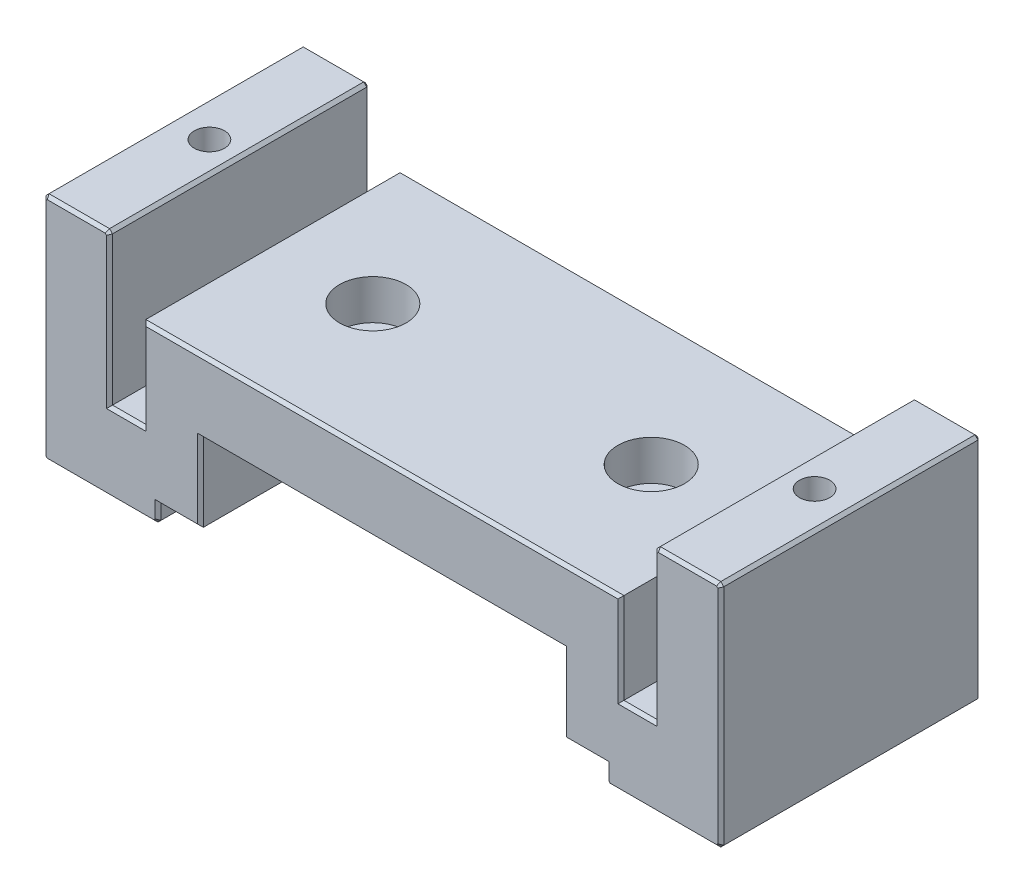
SolidWorks part; units mm, degrees
ref_plane "前视基准面" through (0, 0, 0) normal (0, 0, 1) x (1, 0, 0)
ref_plane "上视基准面" through (0, 0, 0) normal (0, 1, 0) x (1, 0, 0)
ref_plane "右视基准面" through (0, 0, 0) normal (1, 0, 0) x (0, 0, -1)
sketch "Model" plane through (0, 0, 0) normal (0, 0, 1) x (1, 0, 0)
  line L3 (-570.968, 2207.4695) -> (-570.968, 2209.9695)
  line L9 (-663.968, 2207.4695) -> (-663.968, 2244.4695)
  line L12 (-562.468, 2244.9695) -> (-562.968, 2244.4695)
  line L16 (-552.468, 2206.9695) -> (-551.968, 2207.4695)
  line L17 (-637.968, 2209.9695) -> (-644.968, 2209.9695)
  line L21 (-663.468, 2206.9695) -> (-663.968, 2207.4695)
  line L40 (-552.468, 2206.9695) -> (-570.468, 2206.9695)
  line L42 (-644.968, 2209.9695) -> (-644.968, 2207.4695)
  line L45 (-562.968, 2219.9695) -> (-562.968, 2244.4695)
  line L46 (-645.468, 2206.9695) -> (-663.468, 2206.9695)
  line L49 (-568.468, 2219.9695) -> (-562.968, 2219.9695)
  line L50 (-570.968, 2207.4695) -> (-570.468, 2206.9695)
  line L51 (-663.468, 2244.9695) -> (-663.968, 2244.4695)
  line L53 (-645.468, 2206.9695) -> (-644.968, 2207.4695)
  line L55 (-568.468, 2234.9695) -> (-568.468, 2219.9695)
  line L56 (-637.968, 2222.9695) -> (-637.968, 2209.9695)
  line L59 (-551.968, 2244.4695) -> (-552.468, 2244.9695)
  line L61 (-562.468, 2244.9695) -> (-552.468, 2244.9695)
  line L63 (-647.468, 2234.9695) -> (-568.468, 2234.9695)
  line L64 (-570.968, 2209.9695) -> (-577.968, 2209.9695)
  line L67 (-647.468, 2219.9695) -> (-647.468, 2234.9695)
  line L68 (-577.968, 2209.9695) -> (-577.968, 2222.9695)
  line L71 (-652.968, 2219.9695) -> (-647.468, 2219.9695)
  line L72 (-577.968, 2222.9695) -> (-637.968, 2222.9695)
  line L74 (-652.968, 2244.4695) -> (-652.968, 2219.9695)
  line L75 (-551.968, 2244.4695) -> (-551.968, 2207.4695)
  line L78 (-652.968, 2244.4695) -> (-653.468, 2244.9695)
  line L79 (-663.468, 2244.9695) -> (-653.468, 2244.9695)
extrude "凸台-拉伸1" add sketch "Model" along normal mid plane 43
hole_wizard "M6 螺纹孔1" positions "草图2" profile "草图1" tap size "M6" standard "GB"
sketch "草图2" plane through (0, 2244.9695, 0) normal (0, 1, 0) x (1, 0, 0)
  line L0 (-607.968, 21.5) -> (-607.968, -21.5) construction
  line L1 (-568.468, 21.5) -> (-647.468, 21.5) construction
  line L2 (-568.468, -21.5) -> (-647.468, -21.5) construction
  line L4 (-663.968, 0) -> (-551.968, 0) construction
  line L5 (-663.968, -21.5) -> (-663.968, 21.5) construction
  line L6 (-551.968, -21.5) -> (-551.968, 21.5) construction
  point P0 (-657.968, 0)
  point P2 (-557.968, 0)
  dimension "D1" = 100
sketch "草图1" plane through (-657.968, 2244.9695, 0) normal (1, 0, 0) x (0, 0, 1)
  line L0 (0, 0) -> (0, 16.5022)
  line L1 (0, 16.5022) -> (2.5, 15)
  line L2 (2.5, 15) -> (2.5, 0)
  line L5 (2.5, 0) -> (0, 0)
  line L10 (0, 16.5022) -> (-2.5, 15) construction
  line L11 (0, -6.35) -> (0, 107.95) construction
  dimension "螺纹孔钻头直径" = 5
  dimension "螺纹孔钻头深度" = 15
  dimension "导头角度" = 118
hole_wizard "M3 螺纹孔1" positions "草图4" profile "草图5" tap size "M3" standard "GB"
sketch "草图4" plane through (0, 2206.9695, 0) normal (0, -1, 0) x (-1, 0, 0)
  line L0 (557.968, 0) -> (657.968, 0) construction
  line L2 (607.968, 21.5) -> (607.968, -21.5) construction
  line L3 (637.968, 21.5) -> (577.968, 21.5) construction
  line L4 (637.968, -21.5) -> (577.968, -21.5) construction
  line L6 (557.968, 0) -> (557.968, -15.2859) construction
  line L8 (657.968, 0) -> (657.968, -13.3328) construction
  point P0 (557.968, 4)
  point P2 (557.968, -4)
  point P5 (657.968, 4)
  point P7 (657.968, -4)
  dimension "D1" = 8
sketch "草图5" plane through (-557.968, 2206.9695, -4) normal (1, 0, 0) x (0, 0, -1)
  line L0 (0, 0) -> (0, 8.2511)
  line L1 (0, 8.2511) -> (1.25, 7.5)
  line L2 (1.25, 7.5) -> (1.25, 0)
  line L5 (1.25, 0) -> (0, 0)
  line L10 (0, 8.2511) -> (-1.25, 7.5) construction
  line L11 (0, -6.35) -> (0, 107.95) construction
  dimension "螺纹孔钻头直径" = 2.5
  dimension "螺纹孔钻头深度" = 7.5
  dimension "导头角度" = 118
hole_wizard "打孔尺寸(%根据六角头螺)栓 C 级的类型1" positions "草图7" profile "草图6" counterbore size "M6" standard "GB"
sketch "草图7" plane through (0, 2234.9695, 0) normal (0, 1, 0) x (1, 0, 0)
  line L0 (-607.968, 21.5) -> (-607.968, -21.5) construction
  line L1 (-568.468, 21.5) -> (-647.468, 21.5) construction
  line L2 (-568.468, -21.5) -> (-647.468, -21.5) construction
  line L4 (-657.968, 0) -> (-557.968, 0) construction
  point P0 (-584.968, 0)
  point P2 (-630.968, 0)
  dimension "D1" = 46
sketch "草图6" plane through (-584.968, 2234.9695, 0) normal (1, 0, 0) x (0, 0, 1)
  line L0 (0, 0) -> (0, 28)
  line L1 (0, 28) -> (3.3, 28)
  line L3 (3.3, 28) -> (3.3, 6.6)
  line L4 (3.3, 6.6) -> (5.5, 6.6)
  line L5 (5.5, 6.6) -> (5.5, 0)
  line L7 (5.5, 0) -> (0, 0)
  line L11 (0, -6.35) -> (0, 107.95) construction
  dimension "通孔孔直径" = 6.6
  dimension "通孔孔深度" = 28
  dimension "柱形沉头孔直径" = 11
  dimension "柱形沉头孔深度" = 6.6
chamfer "倒角1" distance 0.5 angle 45 56 edges at (-561.468, 2206.9695, -21.5) (-552.218, 2207.2195, -21.5) (-551.968, 2225.9695, -21.5) (-552.218, 2244.7195, -21.5) (-557.468, 2244.9695, -21.5) (-562.718, 2244.7195, -21.5) (-562.968, 2232.2195, -21.5) (-565.718, 2219.9695, -21.5) (-568.468, 2227.4695, -21.5) (-607.968, 2234.9695, -21.5) (-647.468, 2227.4695, -21.5) (-650.218, 2219.9695, -21.5) (-652.968, 2232.2195, -21.5) (-653.218, 2244.7195, -21.5) (-658.468, 2244.9695, -21.5) (-663.718, 2244.7195, -21.5) (-663.968, 2225.9695, -21.5) (-663.718, 2207.2195, -21.5) (-654.468, 2206.9695, -21.5) (-645.218, 2207.2195, -21.5) (-644.968, 2208.7195, -21.5) (-641.468, 2209.9695, -21.5) (-637.968, 2216.4695, -21.5) (-607.968, 2222.9695, -21.5) (-577.968, 2216.4695, -21.5) (-574.468, 2209.9695, -21.5) (-570.968, 2208.7195, -21.5) (-570.718, 2207.2195, -21.5) (-570.968, 2208.7195, 21.5) (-574.468, 2209.9695, 21.5) (-577.968, 2216.4695, 21.5) (-607.968, 2222.9695, 21.5) (-637.968, 2216.4695, 21.5) (-641.468, 2209.9695, 21.5) (-644.968, 2208.7195, 21.5) (-645.218, 2207.2195, 21.5) (-654.468, 2206.9695, 21.5) (-663.718, 2207.2195, 21.5) (-663.968, 2225.9695, 21.5) (-663.718, 2244.7195, 21.5) (-658.468, 2244.9695, 21.5) (-653.218, 2244.7195, 21.5) (-652.968, 2232.2195, 21.5) (-650.218, 2219.9695, 21.5) (-647.468, 2227.4695, 21.5) (-607.968, 2234.9695, 21.5) (-568.468, 2227.4695, 21.5) (-565.718, 2219.9695, 21.5) (-562.968, 2232.2195, 21.5) (-562.718, 2244.7195, 21.5) (-557.468, 2244.9695, 21.5) (-552.218, 2244.7195, 21.5) (-551.968, 2225.9695, 21.5) (-552.218, 2207.2195, 21.5) (-561.468, 2206.9695, 21.5) (-570.718, 2207.2195, 21.5)
